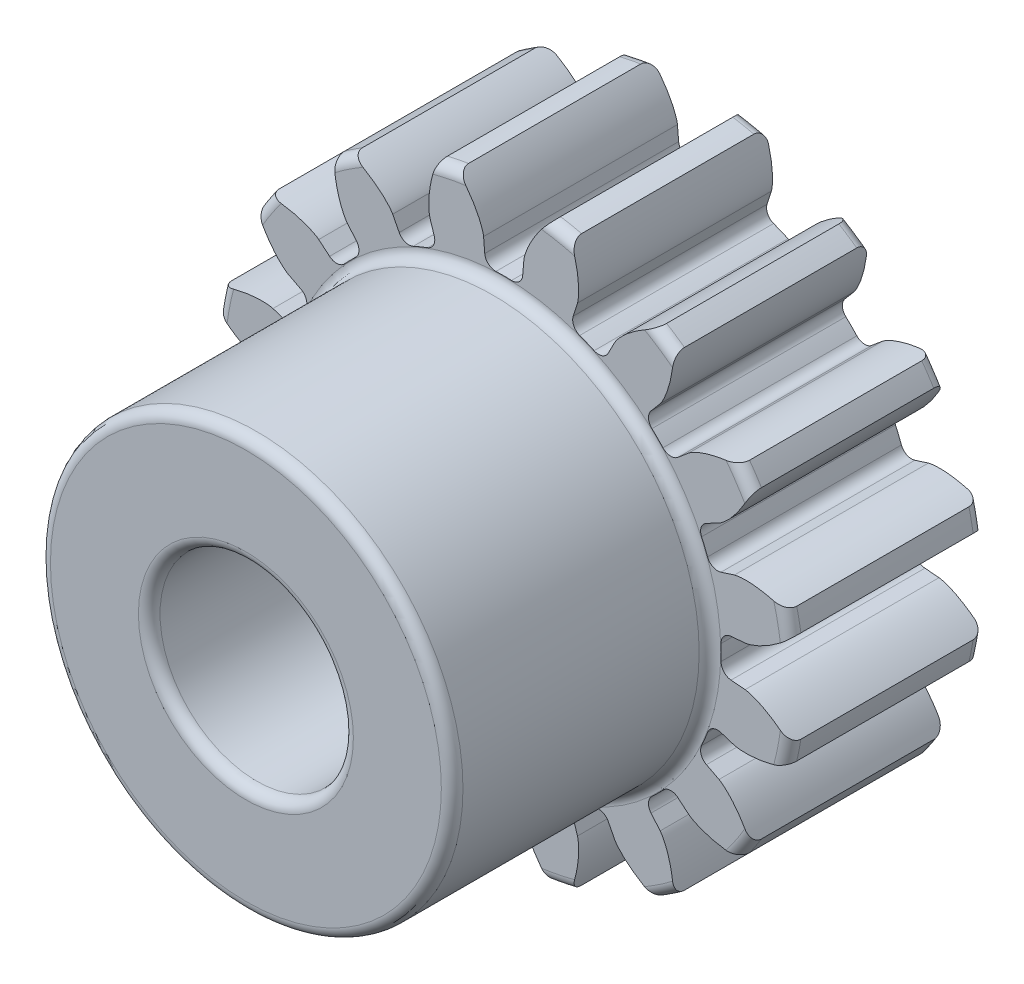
SolidWorks part; units mm, degrees
ref_plane "Front Plane" through (0, 0, 0) normal (0, 0, 1) x (1, 0, 0)
ref_plane "Top Plane" through (0, 0, 0) normal (0, 1, 0) x (1, 0, 0)
ref_plane "Right Plane" through (0, 0, 0) normal (1, 0, 0) x (0, 0, -1)
sketch "Sketch1" plane through (0, 0, 0) normal (0, 0, 1) x (1, 0, 0)
  line L0 (0, 0) -> (0, 6.35) construction
  line L1 (-2.0409, 7.0928) -> (2.0409, 5.6072) construction
  circle A0 centre (0, 0) radius 5.3578 construction
  circle A1 centre (0, 0) radius 7.1438 construction
  circle A2 centre (0, 0) radius 6.35 construction
  circle A3 centre (0, 0) radius 5.967 construction
  circle A4 centre (0, 0) radius 2.3813 construction
  circle A5 centre (0, 0) radius 5.08 construction
  point P8 (406.4, 0)
  point P13 (203.2, 0)
sketch "Sketch2" plane through (0, 0, 0) normal (1, 0, 0) x (0, 0, -1)
  line L0 (-5.5626, 0) -> (5.5626, 0) construction
  line L1 (-5.5626, 7.1438) -> (5.5626, 7.1438) construction
  point P2 (0, 7.1438)
  point P4 (0.7874, 0)
  point P6 (0.7874, 7.1438)
  dimension "Overall Width" = 11.1252
  dimension "Hub Width" = 6.35
  dimension "Face Width" = 4.7752
sketch "Sketch3" plane through (0, 0, 0) normal (0, 0, 1) x (1, 0, 0)
  circle A0 centre (0, 0) radius 7.1438
  circle A1 centre (0, 0) radius 7.1438 construction
extrude "Boss-Extrude1" add sketch "Sketch3" against normal up to vertex (5.5626 mm away) and the other way up to vertex (5.5626 mm away)
sketch "Sketch5" plane through (0, 0, 0) normal (1, 0, 0) x (0, 0, -1)
  line L1 (-5.5626, 7.1438) -> (0.7874, 7.1438)
  line L2 (-5.5626, 7.1438) -> (-5.5626, 5.08)
  line L3 (-5.5626, 5.08) -> (0.7874, 5.08)
  line L4 (0.7874, 7.1438) -> (0.7874, 5.08)
  line L11 (5.5626, 2.3813) -> (-5.5626, 2.3812)
  line L12 (5.5626, 2.3813) -> (5.5626, 0)
  line L13 (5.5626, 0) -> (-5.5626, 0)
  line L14 (-5.5626, 2.3812) -> (-5.5626, 0)
  point P5 (0, 2.3813)
  point P12 (0, 5.08)
revolve "Cut-Revolve1" cut sketch "Sketch5" angle 360 about L0
fillet "Fillet2" radius 0.2663 6 edges at (7.1438, 0, -5.5626) (2.3813, 0, -5.5626) (2.3812, 0, 5.5626) (5.08, 0, -0.7874) (7.1438, 0, -0.7874) (5.08, 0, 5.5626)
sketch "Sketch4" plane through (0, 0, 0) normal (0, 0, 1) x (1, 0, 0)
  line L0 (0, 0) -> (5.3392, 0.4456) construction
  line L2 (0, 0) -> (5.3392, -0.4456) construction
  line L4 (5.3392, 0.4456) -> (5.9464, 0.4963)
  line L5 (5.9464, -0.4963) -> (5.3392, -0.4456)
  arc A0 (5.3392, 0.4456) -> (5.3392, -0.4456) centre (0, 0) cw
  arc A3 (7.0532, 1.1337) -> (7.0532, -1.1337) centre (0, 0) cw
  circle A4 centre (0, 0) radius 7.1438 construction
  spline S0 degree 4 poles (5.9464, 0.4963) (5.9483, 0.4965) (5.9536, 0.4971) (5.9636, 0.4986) (5.98, 0.5014) (6.0007, 0.5057) (6.0273, 0.512) (6.0585, 0.5205) (6.0926, 0.5308) (6.1295, 0.5431) (6.1661, 0.5564) (6.2024, 0.5705) (6.2383, 0.5854) (6.2816, 0.6044) (6.3331, 0.6286) (6.3927, 0.6587) (6.4597, 0.6951) (6.5271, 0.7346) (6.5928, 0.7755) (6.6583, 0.8189) (6.7211, 0.8626) (6.7855, 0.9102) (6.8444, 0.9553) (6.9094, 1.0082) (6.9616, 1.0517) (7.0292, 1.1116) (7.0688, 1.1477) (7.1147, 1.1909) (7.1349, 1.2106) (7.1473, 1.2226) knots 0 0 0 0 0 0.005377 0.015084 0.028532 0.04661 0.064855 0.092111 0.119476 0.146842 0.174209 0.201575 0.228941 0.256307 0.307035 0.361767 0.4165 0.471232 0.525964 0.580697 0.635429 0.690161 0.744894 0.799626 0.854358 0.909091 0.954545 1 1 1 1 1 construction
  spline S1 degree 4 poles (5.9464, 0.4963) (5.9483, 0.4965) (5.9536, 0.4971) (5.9636, 0.4986) (5.98, 0.5014) (6.0007, 0.5057) (6.0273, 0.512) (6.0585, 0.5205) (6.0926, 0.5308) (6.1295, 0.5431) (6.1661, 0.5564) (6.2024, 0.5705) (6.2383, 0.5854) (6.2816, 0.6044) (6.3331, 0.6286) (6.3927, 0.6587) (6.4597, 0.6951) (6.5271, 0.7346) (6.5928, 0.7755) (6.6583, 0.8189) (6.7211, 0.8626) (6.7855, 0.9102) (6.8444, 0.9553) (6.9094, 1.0082) (6.9616, 1.0517) (7.0145, 1.0986) (7.0402, 1.1217) (7.0532, 1.1337) knots 0 0 0 0 0 0.005377 0.015084 0.028532 0.04661 0.064855 0.092111 0.119476 0.146842 0.174209 0.201575 0.228941 0.256307 0.307035 0.361767 0.4165 0.471232 0.525964 0.580697 0.635429 0.690161 0.744894 0.799626 0.854358 0.909091 0.909091 0.909091 0.909091 0.909091
  spline S2 degree 4 poles (5.9464, -0.4963) (5.9483, -0.4965) (5.9536, -0.4971) (5.9636, -0.4986) (5.98, -0.5014) (6.0007, -0.5057) (6.0273, -0.512) (6.0585, -0.5205) (6.0926, -0.5308) (6.1295, -0.5431) (6.1661, -0.5564) (6.2024, -0.5705) (6.2383, -0.5854) (6.2816, -0.6044) (6.3331, -0.6286) (6.3927, -0.6587) (6.4597, -0.6951) (6.5271, -0.7346) (6.5928, -0.7755) (6.6583, -0.8189) (6.7211, -0.8626) (6.7855, -0.9102) (6.8444, -0.9553) (6.9094, -1.0082) (6.9616, -1.0517) (7.0292, -1.1116) (7.0688, -1.1477) (7.1147, -1.1909) (7.1349, -1.2106) (7.1473, -1.2226) knots 0 0 0 0 0 0.005377 0.015084 0.028532 0.04661 0.064855 0.092111 0.119476 0.146842 0.174209 0.201575 0.228941 0.256307 0.307035 0.361767 0.4165 0.471232 0.525964 0.580697 0.635429 0.690161 0.744894 0.799626 0.854358 0.909091 0.954545 1 1 1 1 1 construction
  spline S3 degree 4 poles (5.9464, -0.4963) (5.9483, -0.4965) (5.9536, -0.4971) (5.9636, -0.4986) (5.98, -0.5014) (6.0007, -0.5057) (6.0273, -0.512) (6.0585, -0.5205) (6.0926, -0.5308) (6.1295, -0.5431) (6.1661, -0.5564) (6.2024, -0.5705) (6.2383, -0.5854) (6.2816, -0.6044) (6.3331, -0.6286) (6.3927, -0.6587) (6.4597, -0.6951) (6.5271, -0.7346) (6.5928, -0.7755) (6.6583, -0.8189) (6.7211, -0.8626) (6.7855, -0.9102) (6.8444, -0.9553) (6.9094, -1.0082) (6.9616, -1.0517) (7.0145, -1.0986) (7.0402, -1.1217) (7.0532, -1.1337) knots 0 0 0 0 0 0.005377 0.015084 0.028532 0.04661 0.064855 0.092111 0.119476 0.146842 0.174209 0.201575 0.228941 0.256307 0.307035 0.361767 0.4165 0.471232 0.525964 0.580697 0.635429 0.690161 0.744894 0.799626 0.854358 0.909091 0.909091 0.909091 0.909091 0.909091
extrude "Cut-Extrude1" cut sketch "Sketch4" against normal through all both and the other way through all
fillet "Fillet1" radius 0.2663 2 edges at (5.3392, -0.4456, -3.175) (5.3392, 0.4456, -3.175)
pattern_circular "CirPattern1" count 16 over 360 about axis through (0, 0, 5.5626) along (0, 0, -1) of "Cut-Extrude1", "Fillet1"
equation "\"Root Diameter@Sketch1\"=\"Root Diameter\""
equation "\"OD | Outside Diameter@Sketch1\"=\"Outside Diameter\""
equation "\"D1@CirPattern1\"=\"Number of Teeth\""
equation "\"Diametral Pitch\"=32"
equation "\"Number of Teeth\"= 16"
equation "\"Pressure Angle\"=20"
equation "\"Pitch Diameter\"= \"Number of Teeth\" / \"Diametral Pitch\""
equation "\"Base Diameter\"= \"Pitch Diameter\" * cos ( \"Pressure Angle\" )"
equation "\"Outside Diameter\"= ( \"Number of Teeth\" + 2 ) / \"Diametral Pitch\""
equation "\"Dedendum\"= 1.25 / \"Diametral Pitch\""
equation "\"Root Diameter\"= \"Pitch Diameter\" - ( 2 * \"Dedendum\" )"
equation "\"Pitch Angle\"= 360deg / \"Number of Teeth\""
equation "\"Alpha\"= sqr ( \"Pitch Diameter\" ^ 2 - \"Base Diameter\" ^ 2 ) / \"Base Diameter\" * 180 / PI - \"Pressure Angle\""
equation "\"Beta\"= ( \"Pitch Angle\" / 4 - \"Alpha\" )"
equation "\"Phi\"= sqr ( ( \"Outside Diameter\" / 2 ) ^ 2 - ( \"Base Diameter\" / 2 ) ^ 2 ) / ( \"Base Diameter\" / 2 )"
equation "\"Addendum\"= 1 / \"Diametral Pitch\""
equation "\"WorkingDepth\"= 2 / \"Diametral Pitch\""
equation "\"WholeDepth\"= 2.25 / \"Diametral Pitch\""
equation "\"Clearance\"= 0.25 / \"Diametral Pitch\""
equation "\"ToothThickness\"= ( pi * 2 ) / \"Diametral Pitch\""
equation "\"CircularPitch\"= pi / \"Diametral Pitch\""
equation "\"Number of Teeth@Sketch1\"=\"Number of Teeth\""
equation "\"Gear Pitch | Diametral Pitch@Sketch1\"=\"Diametral Pitch\""
equation "\"Pressure Angle@Sketch1\"=\"Pressure Angle\""
equation "\"Gear Pitch Diameter@Sketch1\"=\"Pitch Diameter\""
equation "\"Base Diameter@Sketch1\"=\"Base Diameter\""
equation "\"Fillet\"= \"Clearance\" * cos ( \"Pressure Angle\" ) * tan ( ( 90 + \"Pressure Angle\" ) / 2 )"
equation "\"D1@Fillet1\"=\"Fillet\""
equation "\"D1@Sketch4\"=if( \"Base Diameter\">\"Root Diameter\",\"Root Diameter\",\"Base Diameter\"-.00001)"
equation "\"D1@Fillet2\"=\"Fillet\""
